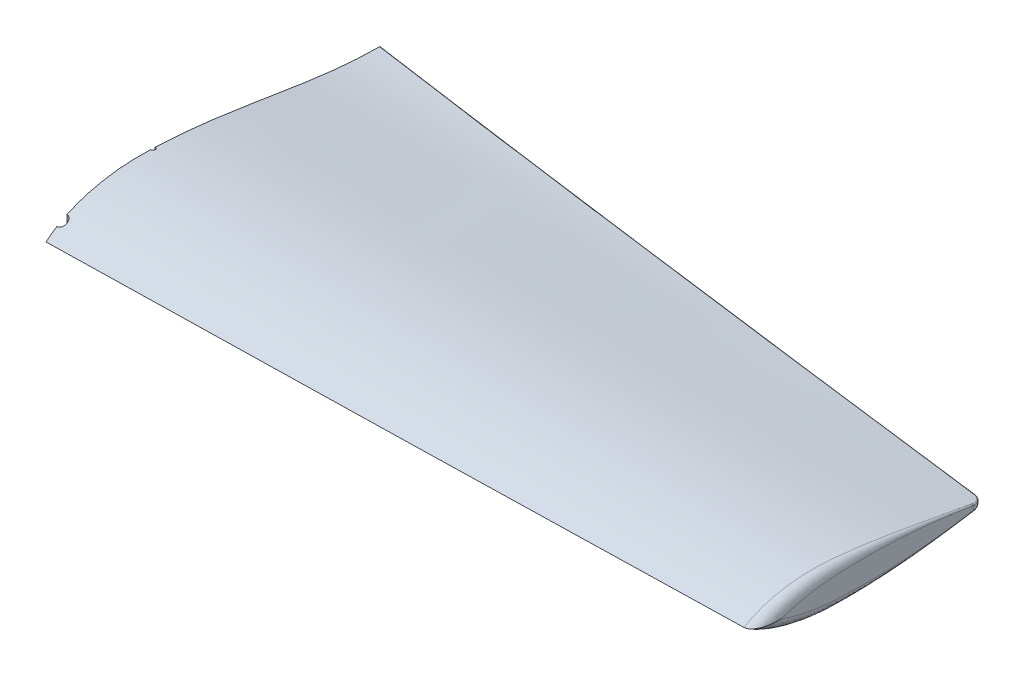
SolidWorks part; units mm, degrees
ref_plane "Plan de face" through (0, 0, 0) normal (0, 0, 1) x (1, 0, 0)
ref_plane "Plan de dessus" through (0, 0, 0) normal (0, 1, 0) x (1, 0, 0)
ref_plane "Plan de droite" through (0, 0, 0) normal (1, 0, 0) x (0, 0, -1)
sketch "Esquisse1" plane through (0, 0, 0) normal (1, 0, 0) x (0, 0, -1)
  line L0 (-79.0921, 0) -> (468.674, 0) construction
  line L1 (147, -10.1384) -> (147, 21.7541) construction
  line L2 (159.3979, 1) -> (141.3568, 1) construction
  line L20 (38.079, 12.2) -> (41.0559, 12.2) construction
  line L51 (147, -1) -> (147, 1)
  spline S0 degree 3 poles (0, 0) (10.0154, 8.6682) (26.514, 12.1435) (52.9406, 12.2543) (89.4118, 8.6393) (124.8589, 1.0117) (147, 1) knots 0 0 0 0 0.279871 0.279871 0.548423 1 1 1 1
  spline S1 degree 3 poles (0, 0) (10.0154, -8.6682) (26.514, -12.1435) (52.9406, -12.2543) (89.4118, -8.6393) (124.8589, -1.0117) (147, -1) knots 0 0 0 0 0.279871 0.279871 0.548423 1 1 1 1
  dimension "D1" = 1
extrude "Boss.-Extru.1" add sketch "Esquisse1" along normal blind 305
draft "Dépouille2" type of draft neutral plane draft angle 7.5 faces to draft 1 parameters "D1"=7.5
draft "Dépouille7" type of draft neutral plane draft angle 0.75 faces to draft 2 parameters "D1"=0.75
fillet "Congé4" radius 5 1 edges at (305, 0, -106.846)
fillet "Congé variable2" radius 5 2 edges at (305, 7.4795, -29.6164) (305, -5.6155, -20.2559)
ref_plane "Plan1" through (0, 0, 0) normal (0, 1, 0) x (-1, 0, 0)
sketch "Esquisse2" plane through (0, 0, 0) normal (0, 1, 0) x (-1, 0, 0)
  line L0 (0, 25.7428) -> (0, -169.6303) construction
  line L1 (27.5303, 0) -> (-74.5222, 0) construction
  line L2 (27.5303, -7) -> (-7.3968, -7) construction
  line L3 (27.5303, -47) -> (-7.3968, -47) construction
  circle A0 centre (0, -7) radius 2.2
  circle A1 centre (0, -47) radius 1
  dimension "D1" = 7
  dimension "D2" = 40
extrude "Enlèv. mat.-Extru.1" cut sketch "Esquisse2" against normal mid plane 30
